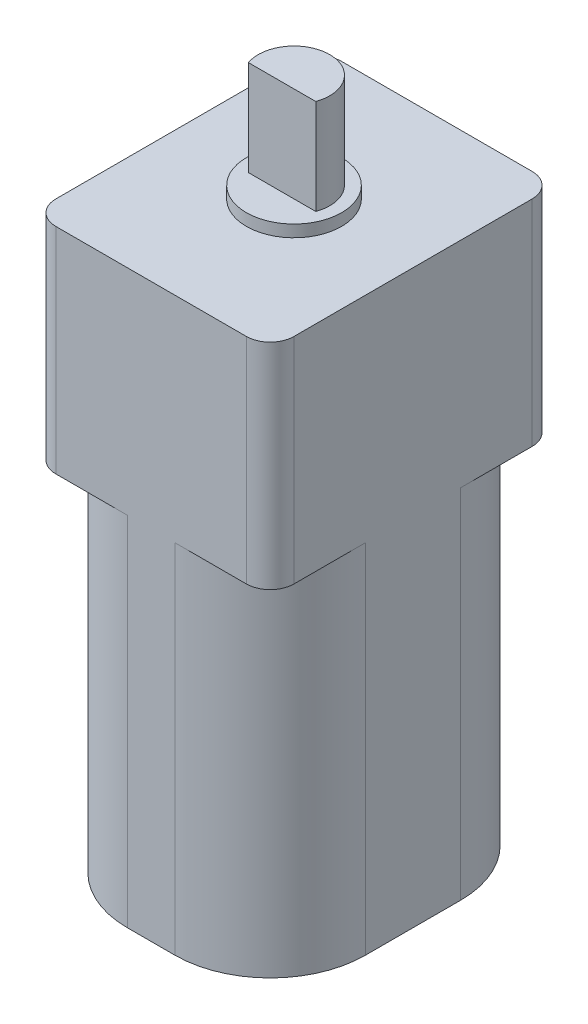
SolidWorks part; units mm, degrees
ref_plane "前视基准面" through (0, 0, 0) normal (0, 0, 1) x (1, 0, 0)
ref_plane "上视基准面" through (0, 0, 0) normal (0, 1, 0) x (1, 0, 0)
ref_plane "右视基准面" through (0, 0, 0) normal (1, 0, 0) x (0, 0, -1)
sketch "草图1" plane through (0, 0, 0) normal (0, 0, 1) x (1, 0, 0)
  line L0 (-26.1697, 0) -> (22.6804, 0) construction
  line L1 (0, 28.5854) -> (0, -20.8016) construction
  line L3 (-5, 7.5) -> (5, 7.5)
  line L4 (-5, 7.5) -> (-5, -7.5)
  line L5 (-5, -7.5) -> (5, -7.5)
  line L6 (5, 7.5) -> (5, -7.5)
  line L7 (-5, 7.5) -> (5, -7.5) construction
  line L8 (-5, -7.5) -> (5, 7.5) construction
  point P5 (0, 0)
extrude "凸台-拉伸1" add sketch "草图1" along normal blind 12
fillet "圆角1" radius 4 4 edges at (5, 0, 12) (-5, 0, 12) (5, 0, 0) (-5, 0, 0)
sketch "草图2" plane through (0, 7.5, 0) normal (0, 1, 0) x (1, 0, 0)
  line L0 (0, -12) -> (0, 0) construction
  line L1 (1, -12) -> (-1, -12) construction
  line L2 (1, 0) -> (-1, 0) construction
  line L3 (5, -6) -> (-4.594, -6) construction
  line L4 (5, -8) -> (5, -4) construction
  line L6 (5, -12) -> (-5, -12)
  line L7 (5, -12) -> (5, 0)
  line L8 (5, 0) -> (-5, 0)
  line L9 (-5, -12) -> (-5, 0)
  line L10 (5, -12) -> (-5, 0) construction
  line L11 (5, 0) -> (-5, -12) construction
  point P10 (0, -6)
extrude "凸台-拉伸2" add sketch "草图2" along normal blind 9
fillet "圆角2" radius 1 4 edges at (-5, 12, 0) (-5, 12, 12) (5, 12, 12) (5, 12, 0)
sketch "草图3" plane through (0, 16.5, 0) normal (0, 1, 0) x (1, 0, 0)
  line L0 (0, -12) -> (0, 0) construction
  line L1 (-4, -12) -> (4, -12) construction
  line L2 (4, 0) -> (-4, 0) construction
  line L3 (5, -11) -> (5, -1) construction
  line L4 (-5, -1) -> (-5, -11) construction
  line L5 (5, -6) -> (-5, -6) construction
  circle A0 centre (0, -6) radius 2
extrude "凸台-拉伸3" add sketch "草图3" along normal blind 0.5
sketch "草图4" plane through (0, 17, 0) normal (0, 1, 0) x (1, 0, 0)
  line L0 (1.4142, -6.5) -> (-1.4142, -6.5)
  arc A0 (1.4142, -6.5) -> (-1.4142, -6.5) centre (0, -6) ccw
  point P5 (0, -6.5)
  dimension "D1" = 3
  dimension "D2" = 0.5
extrude "凸台-拉伸4" add sketch "草图4" along normal blind 4
sketch "草图5" plane through (0, -7.5, 0) normal (0, -1, 0) x (1, 0, 0)
  line L0 (0, 12) -> (0, 0) construction
  line L3 (-5, 6) -> (5, 6) construction
  line L4 (-5, 8) -> (-5, 4) construction
  line L5 (5, 8) -> (5, 4) construction
  circle A0 centre (0, 6) radius 2
  point P7 (0, 12)
  dimension "D1" = 4
extrude "凸台-拉伸5" add sketch "草图5" along normal blind 1
fillet "圆角5" radius 0.5 1 edges at (0, -8.5, 4)
